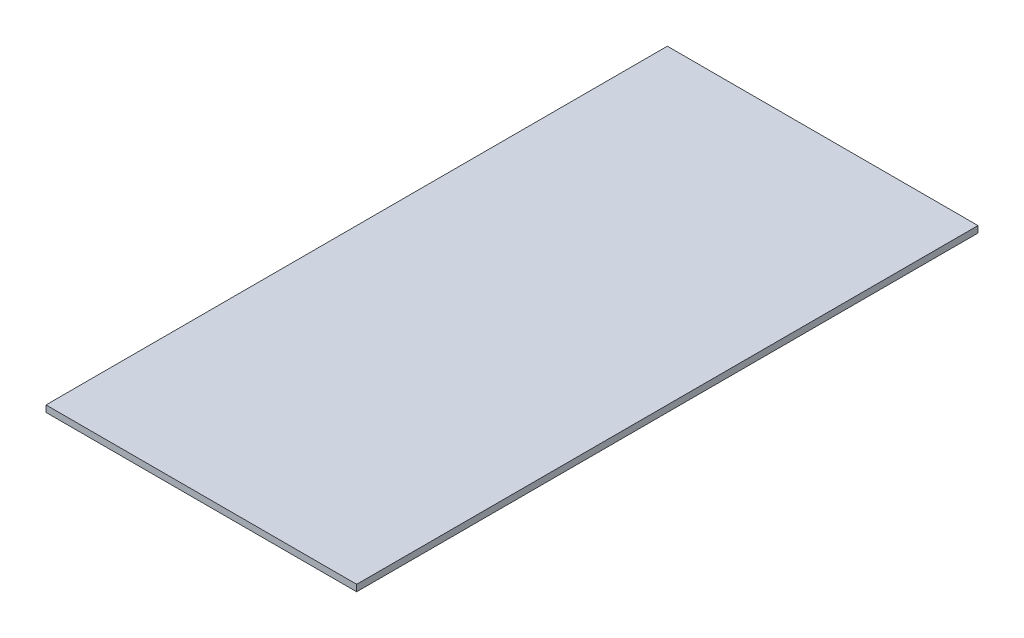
SolidWorks part; units mm, degrees
ref_plane "Front Plane" through (0, 0, 0) normal (0, 0, 1) x (1, 0, 0)
ref_plane "Top Plane" through (0, 0, 0) normal (0, 1, 0) x (1, 0, 0)
ref_plane "Right Plane" through (0, 0, 0) normal (1, 0, 0) x (0, 0, -1)
sketch "Sketch1" plane through (0, 0, 0) normal (0, 1, 0) x (1, 0, 0)
  line L0 (0, 76.2) -> (0, -76.2)
  line L1 (0, 76.2) -> (76.2, 76.2)
  line L3 (76.2, 76.2) -> (76.2, -76.2)
  line L4 (0, 0) -> (59.5147, 0) construction
  line L6 (0, -76.2) -> (76.2, -76.2)
  point P9 (76.2, 0)
  dimension "D3" = 76.2
  dimension "D4" = 152.4
extrude "Boss-Extrude1" add sketch "Sketch1" along normal mid plane 1.6002
